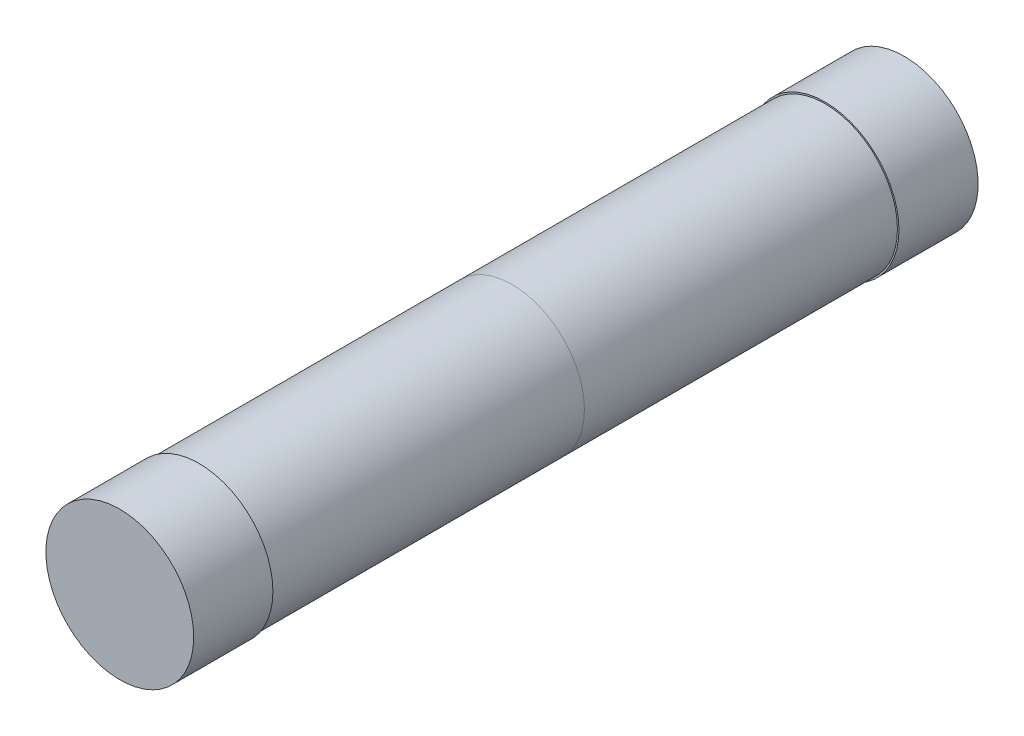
SolidWorks part; units mm, degrees
ref_plane "Front" through (0, 0, 0) normal (0, 0, 1) x (1, 0, 0)
ref_plane "Top" through (0, 0, 0) normal (0, 1, 0) x (1, 0, 0)
ref_plane "Right" through (0, 0, 0) normal (1, 0, 0) x (0, 0, -1)
imported_body "Imported1"
ref_plane "Plane1" through (0, 0, 5.4858) normal (0, 0, 1) x (1, 0, 0)
sketch "Sketch1" plane through (0, 0, 5.4858) normal (0, 0, 1) x (1, 0, 0)
  circle A0 centre (9.6984, -11.2367) radius 0.96
  dimension "D1" = 1.92
extrude "Cut-Extrude1" cut sketch "Sketch1" against normal blind 8.3 flip side to cut
sketch "Sketch2" plane through (0, 0, 0) normal (0, 1, 0) x (1, 0, 0)
  line L0 (6.2976, -1.3358) -> (13.0627, -1.3358)
